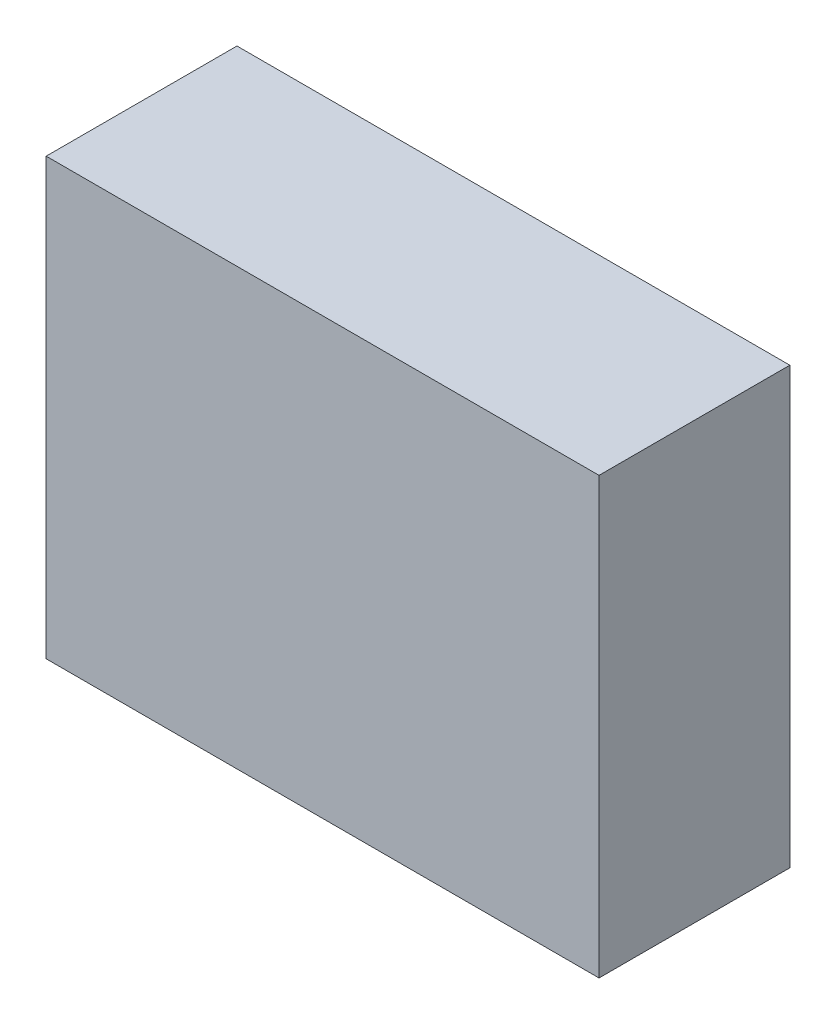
SolidWorks part; units mm, degrees
ref_plane "Front Plane" through (0, 0, 0) normal (0, 0, 1) x (1, 0, 0)
ref_plane "Top Plane" through (0, 0, 0) normal (0, 1, 0) x (1, 0, 0)
ref_plane "Right Plane" through (0, 0, 0) normal (1, 0, 0) x (0, 0, -1)
sketch "GENERAL" plane through (0, 0, 0) normal (0, 0, 1) x (1, 0, 0)
  line L4 (-2.54, -2) -> (2.54, -2)
  line L5 (2.54, -2) -> (2.54, 2)
  line L6 (2.54, 2) -> (-2.54, 2)
  line L7 (-2.54, 2) -> (-2.54, -2)
extrude "Boss-Extrude1" add sketch "GENERAL" along normal blind 1.753
